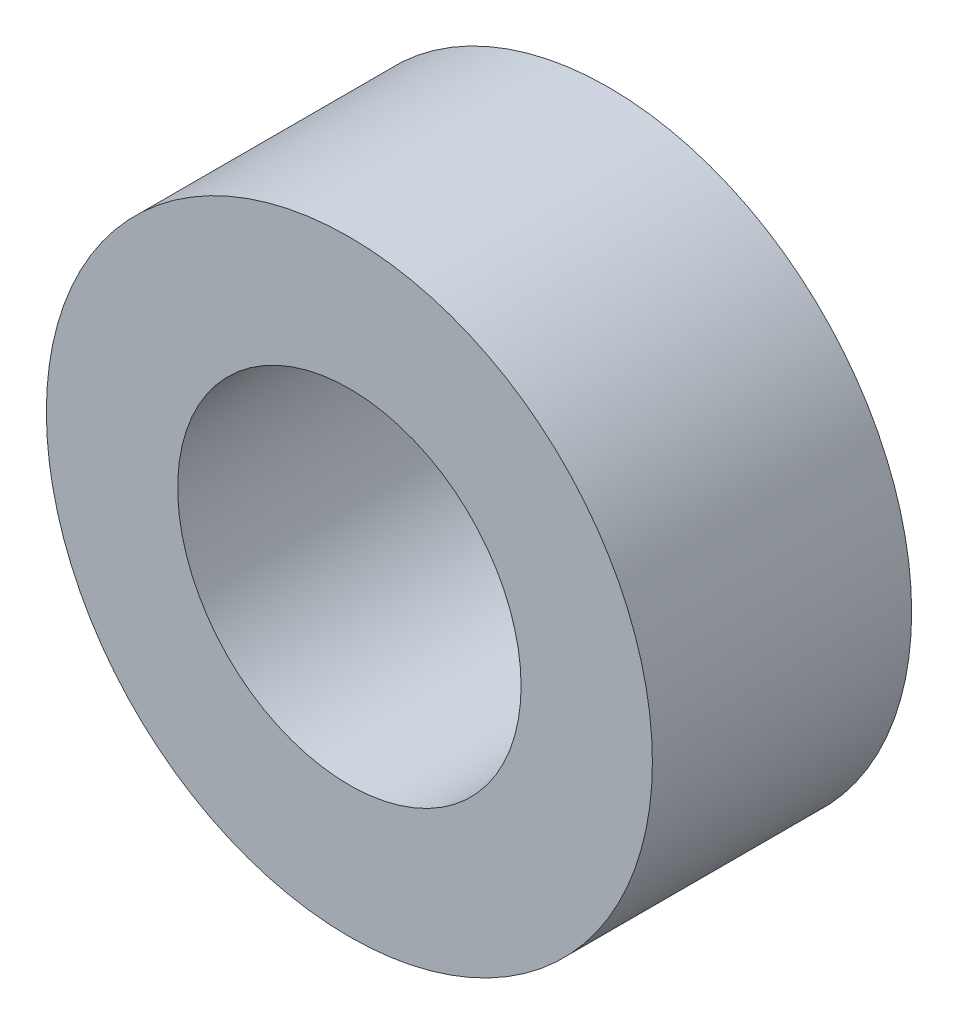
SolidWorks part; units mm, degrees
ref_plane "Plan de face" through (0, 0, 0) normal (0, 0, 1) x (1, 0, 0)
ref_plane "Plan de dessus" through (0, 0, 0) normal (0, 1, 0) x (1, 0, 0)
ref_plane "Plan de droite" through (0, 0, 0) normal (1, 0, 0) x (0, 0, -1)
sketch "Esquisse1" plane through (0, 0, 0) normal (0, 0, 1) x (1, 0, 0)
  circle A0 centre (0, 0) radius 51
  circle A1 centre (0, 0) radius 90
extrude "Boss.-Extru.1" add sketch "Esquisse1" along normal blind 77
